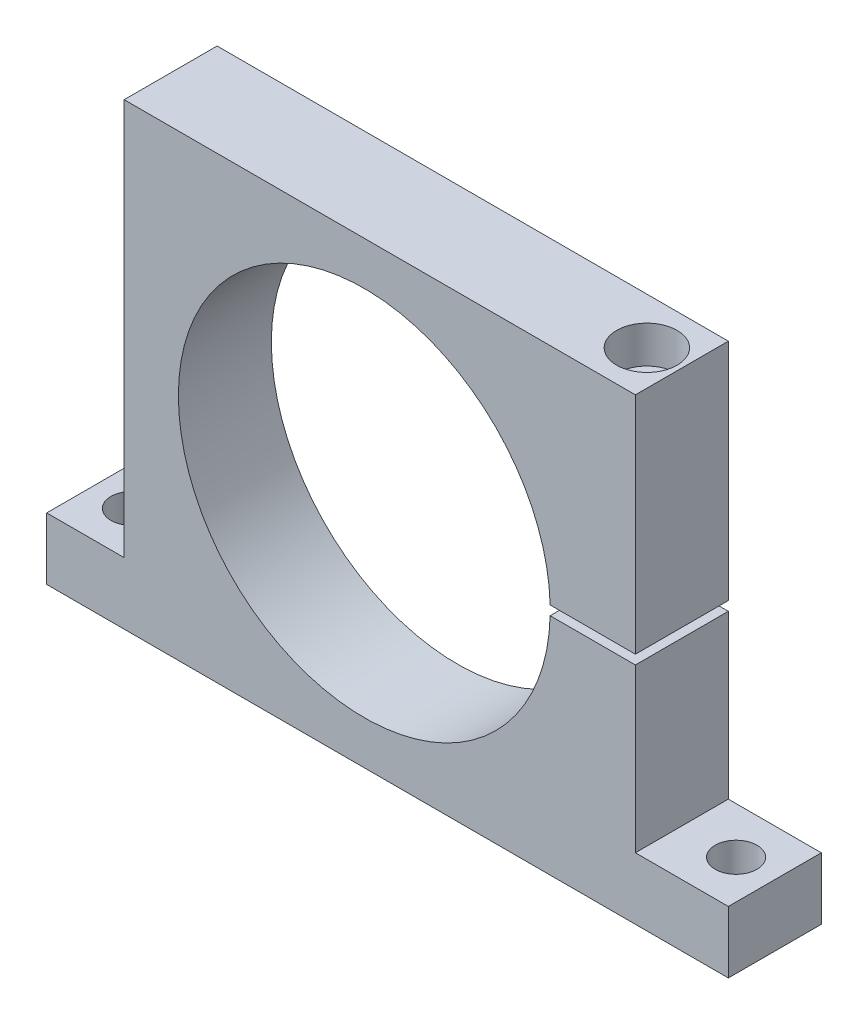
SolidWorks part; units mm, degrees
ref_plane "Front Plane" through (0, 0, 0) normal (0, 0, 1) x (1, 0, 0)
ref_plane "Top Plane" through (0, 0, 0) normal (0, 1, 0) x (1, 0, 0)
ref_plane "Right Plane" through (0, 0, 0) normal (1, 0, 0) x (0, 0, -1)
sketch "Sketch1" plane through (0, 0, 0) normal (0, 0, 1) x (1, 0, 0)
  line L0 (-77.5, 0) -> (87.5, 0) construction
  line L1 (0, 74) -> (0, -74) construction
  line L2 (-77.5, 74) -> (87.5, 74)
  line L3 (87.5, 74) -> (87.5, 1.5)
  line L4 (87.5, -54) -> (117.5, -54)
  line L5 (117.5, -54) -> (117.5, -74)
  line L6 (117.5, -74) -> (-102.5, -74)
  line L7 (-102.5, -74) -> (-102.5, -54)
  line L8 (-102.5, -54) -> (-77.5, -54)
  line L9 (-77.5, -54) -> (-77.5, 74)
  line L10 (87.5, 1.5) -> (59.9812, 1.5)
  line L11 (87.5, -1.5) -> (59.9812, -1.5)
  line L12 (87.5, -1.5) -> (87.5, -54)
  arc A0 (59.9812, 1.5) -> (59.9812, -1.5) centre (0, 0) ccw
  dimension "D1" = 120
  dimension "D2" = 77.5
  dimension "D3" = 25
  dimension "D4" = 148
  dimension "D5" = 20
  dimension "D6" = 165
  dimension "D7" = 74
  dimension "D9" = 220
  dimension "D11" = 3
extrude "Boss-Extrude1" add sketch "Sketch1" along normal mid plane 30
sketch "Sketch2" plane through (0, -74, 0) normal (0, -1, 0) x (1, 0, 0)
  line L0 (-102.5, 0) -> (117.5, 0) construction
  line L1 (-102.5, 15) -> (-102.5, -15) construction
  line L2 (117.5, 15) -> (117.5, -15) construction
  circle A0 centre (-90, 0) radius 6.75
  circle A1 centre (105, 0) radius 6.75
  dimension "D3" = 13.5
  dimension "D1" = 195
  dimension "D2" = 12.5
extrude "Cut-Extrude1" cut sketch "Sketch2" against normal blind 20
sketch "Sketch3" plane through (0, 0, 0) normal (0, 0, 1) x (1, 0, 0)
  line L0 (76.2, 74) -> (76.2, -74) construction
  line L1 (87.5, 74) -> (-77.5, 74) construction
  line L2 (-102.5, -74) -> (117.5, -74) construction
  line L3 (117.5, -74) -> (117.5, -54) construction
  line L4 (76.2, 74) -> (85.95, 74)
  line L5 (85.95, 74) -> (85.95, 62)
  line L6 (85.95, 62) -> (82.2, 62)
  line L7 (82.2, 62) -> (82.2, -46)
  line L8 (82.2, -46) -> (76.2, -49.6052)
  line L9 (76.2, -49.6052) -> (76.2, 74)
  dimension "D1" = 41.3
  dimension "D2" = 12
  dimension "D3" = 19.5
  dimension "D4" = 12
  dimension "D5" = 59
  dimension "D6" = 120
revolve "Cut-Revolve1" cut sketch "Sketch3" angle 360 about L0
